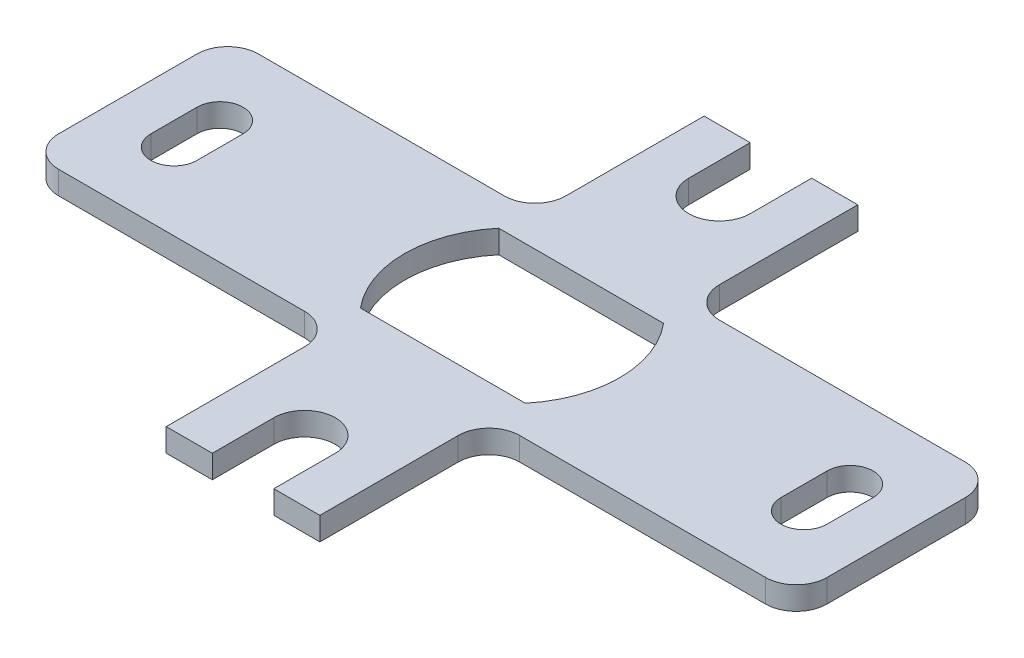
SolidWorks part; units mm, degrees
ref_plane "Front Plane" through (0, 0, 0) normal (0, 0, 1) x (1, 0, 0)
ref_plane "Top Plane" through (0, 0, 0) normal (0, 1, 0) x (1, 0, 0)
ref_plane "Right Plane" through (0, 0, 0) normal (1, 0, 0) x (0, 0, -1)
sketch "Sketch1" plane through (0, 0, 0) normal (0, 1, 0) x (1, 0, 0)
  line L0 (50, 62) -> (50, 8) construction
  line L1 (40, 0) -> (46, 0)
  line L2 (40, 0) -> (0, 0) construction
  line L3 (54, 0) -> (60, 0)
  line L4 (0, 0) -> (0, 35) construction
  line L5 (99.9987, 35) -> (0, 35) construction
  line L6 (54, 70) -> (60, 70)
  line L7 (40, 0) -> (40, 18)
  line L8 (60, 70) -> (60, 52)
  line L10 (54, 8) -> (54, 0)
  line L11 (46, 8) -> (46, 0)
  line L12 (46, 62) -> (46, 70)
  line L13 (54, 62) -> (54, 70)
  line L16 (39.2762, 44) -> (60.7238, 44)
  line L17 (60.7238, 26) -> (39.2762, 26)
  line L19 (46, 70) -> (40, 70)
  line L20 (64, 48) -> (96, 48)
  line L21 (4, 22) -> (36, 22)
  line L22 (0, 26) -> (0, 44)
  line L23 (4, 48) -> (36, 48)
  line L24 (100, 26) -> (100, 44)
  line L25 (40, 52) -> (40, 70)
  line L26 (60, 18) -> (60, 0)
  line L27 (64, 22) -> (96, 22)
  line L28 (91, 38) -> (91, 32) construction
  line L29 (9, 38) -> (9, 32) construction
  line L30 (94, 38) -> (94, 32)
  line L31 (88, 32) -> (88, 38)
  line L32 (12, 38) -> (12, 32)
  line L33 (6, 38) -> (6, 32)
  arc A0 (46, 62) -> (54, 62) centre (50, 62) ccw
  arc A1 (54, 8) -> (46, 8) centre (50, 8) ccw
  arc A2 (39.2762, 44) -> (39.2762, 26) centre (50, 35) ccw
  arc A3 (60.7238, 26) -> (60.7238, 44) centre (50, 35) ccw
  arc A4 (0, 26) -> (4, 22) centre (4, 26) ccw
  arc A5 (4, 48) -> (0, 44) centre (4, 44) ccw
  arc A6 (40, 52) -> (36, 48) centre (36, 52) cw
  arc A7 (64, 48) -> (60, 52) centre (64, 52) cw
  arc A8 (100, 44) -> (96, 48) centre (96, 44) ccw
  arc A9 (96, 22) -> (100, 26) centre (96, 26) ccw
  arc A10 (60, 18) -> (64, 22) centre (64, 18) cw
  arc A11 (40, 18) -> (36, 22) centre (36, 18) ccw
  arc A12 (94, 38) -> (88, 38) centre (91, 38) ccw
  arc A13 (88, 32) -> (94, 32) centre (91, 32) ccw
  arc A14 (12, 38) -> (6, 38) centre (9, 38) ccw
  arc A15 (6, 32) -> (12, 32) centre (9, 32) ccw
  point P10 (0, 22)
  point P39 (40, 48)
  point P48 (60, 22)
  dimension "D4" = 4
  dimension "D5" = 4
  dimension "D6" = 8
  dimension "D7" = 8
  dimension "D11" = 4
  dimension "D17" = 28
  dimension "D18" = 3
  dimension "D22" = 3
  dimension "D23" = 6
  dimension "D2" = 18
  dimension "D3" = 9
  dimension "D8" = 6
  dimension "D9" = 6
  dimension "D10" = 13
  dimension "D12" = 100
  dimension "D13" = 14
  dimension "D14" = 14
  dimension "D15" = 40
  dimension "D16" = 13
  dimension "D19" = 9
  dimension "D20" = 6
  dimension "D21" = 3
  dimension "D24" = 9
  dimension "D25" = 6
  dimension "D26" = 6
  dimension "D27" = 40
extrude "Extrude1" add sketch "Sketch1" along normal blind 3
